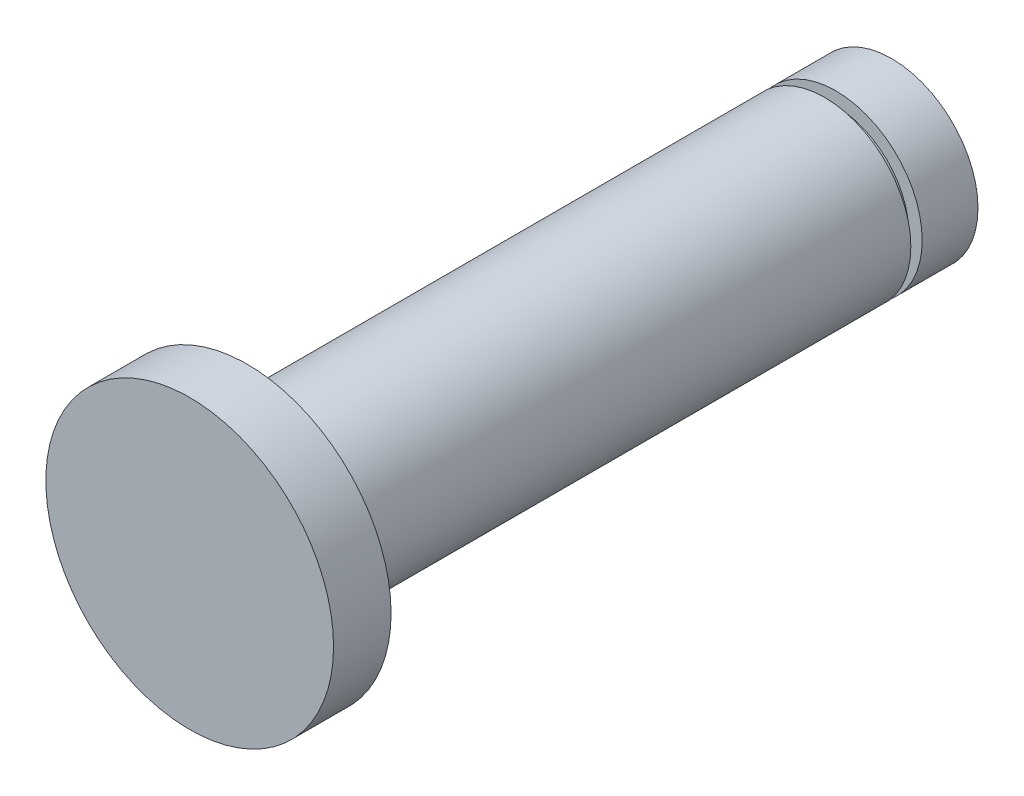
SolidWorks part; units mm, degrees
ref_plane "Plan de face" through (0, 0, 0) normal (0, 0, 1) x (1, 0, 0)
ref_plane "Plan de dessus" through (0, 0, 0) normal (0, 1, 0) x (1, 0, 0)
ref_plane "Plan de droite" through (0, 0, 0) normal (1, 0, 0) x (0, 0, -1)
sketch "Esquisse1" plane through (0, 0, 0) normal (0, 0, 1) x (1, 0, 0)
  circle A0 centre (0, 0) radius 15
  dimension "D1" = 30
extrude "Boss.-Extru.1" add sketch "Esquisse1" along normal blind 112
sketch "Esquisse2" plane through (0, 0, 112) normal (0, 0, 1) x (1, 0, 0)
  circle A0 centre (0, 0) radius 25
  dimension "D1" = 50
extrude "Boss.-Extru.2" add sketch "Esquisse2" along normal blind 10
sketch3d "Esquisse3D1"
  line L0 (0, 0, 0) -> (0, 0, 122.2083) construction
sketch "Esquisse3" plane through (0, 0, 0) normal (1, 0, 0) x (0, 0, -1)
  line L0 (-9.7007, 15) -> (-9.7007, 12.6687)
  line L1 (0, 15) -> (-112, 15) construction
  line L2 (-9.7007, 12.6687) -> (-11.6697, 12.6687)
  line L3 (-11.6697, 12.6687) -> (-11.6697, 15)
  line L4 (-9.7007, 15) -> (-11.6697, 15)
revolve "Enlèvement de matière-Révolution1" cut sketch "Esquisse3" angle 360 about L0
